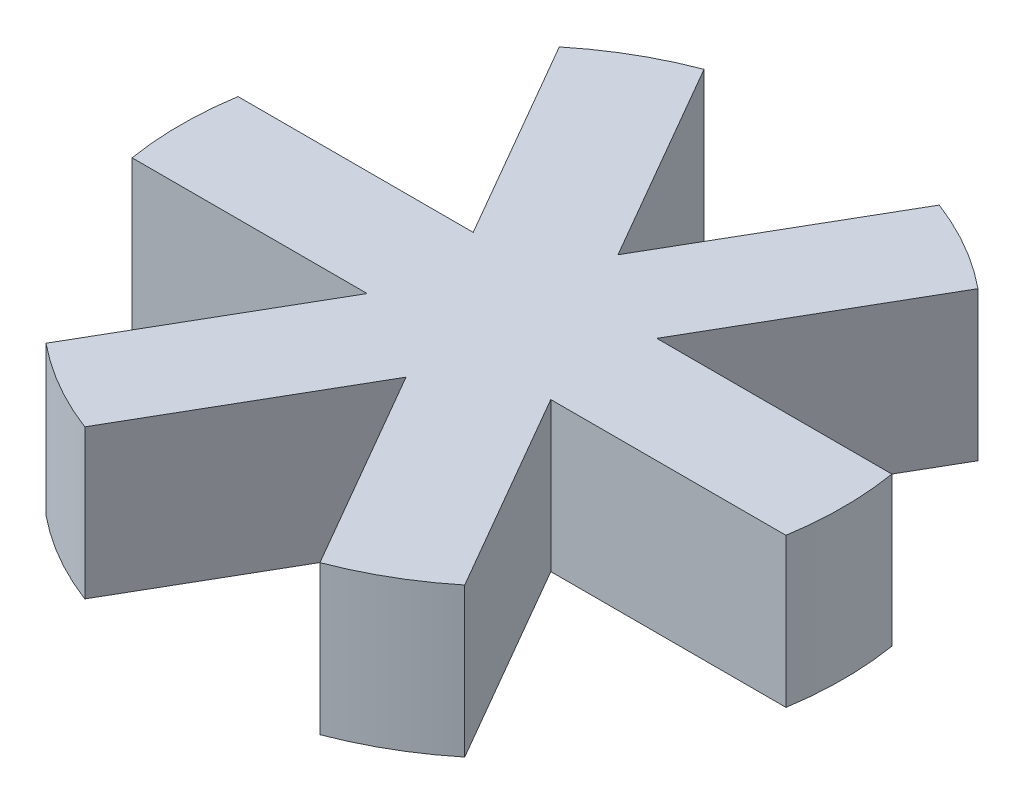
SolidWorks part; units mm, degrees
ref_plane "Front Plane" through (0, 0, 0) normal (0, 0, 1) x (1, 0, 0)
ref_plane "Top Plane" through (0, 0, 0) normal (0, 1, 0) x (1, 0, 0)
ref_plane "Right Plane" through (0, 0, 0) normal (1, 0, 0) x (0, 0, -1)
sketch "Sketch1" plane through (0, 0, 0) normal (0, 1, 0) x (1, 0, 0)
  line L0 (0, 0) -> (7.9375, 0) construction
  line L1 (0, 0) -> (0, 7.9375) construction
  line L2 (0, 1.27) -> (7.8352, 1.27) construction
  line L3 (0, -1.27) -> (7.8352, -1.27) construction
  line L4 (-1.0999, -0.635) -> (2.8178, -7.4205) construction
  line L5 (1.0999, 0.635) -> (5.0175, -6.1505) construction
  line L6 (-1.0999, 0.635) -> (-5.0175, -6.1505) construction
  line L7 (1.0999, -0.635) -> (-2.8178, -7.4205) construction
  line L8 (0, 1.27) -> (-7.8352, 1.27) construction
  line L9 (0, -1.27) -> (-7.8352, -1.27) construction
  line L10 (1.0999, 0.635) -> (-2.8178, 7.4205) construction
  line L11 (-1.0999, -0.635) -> (-5.0175, 6.1505) construction
  line L12 (1.0999, -0.635) -> (5.0175, 6.1505) construction
  line L13 (-1.0999, 0.635) -> (2.8178, 7.4205) construction
  line L14 (2.1997, 1.27) -> (7.8352, 1.27)
  line L15 (2.1997, 1.27) -> (5.0175, 6.1505)
  line L16 (2.1997, -1.27) -> (7.8352, -1.27)
  line L17 (2.1997, -1.27) -> (5.0175, -6.1505)
  line L18 (0, -2.54) -> (2.8178, -7.4205)
  line L19 (0, -2.54) -> (-2.8178, -7.4205)
  line L20 (-2.1997, -1.27) -> (-5.0175, -6.1505)
  line L21 (-2.1997, -1.27) -> (-7.8352, -1.27)
  line L22 (-2.1997, 1.27) -> (-7.8352, 1.27)
  line L23 (-2.1997, 1.27) -> (-5.0175, 6.1505)
  line L24 (0, 2.54) -> (-2.8178, 7.4205)
  line L25 (0, 2.54) -> (2.8178, 7.4205)
  circle A0 centre (0, 0) radius 7.9375 construction
  arc A1 (2.8178, 7.4205) -> (5.0175, 6.1505) centre (0, 0) cw
  arc A2 (7.8352, 1.27) -> (7.8352, -1.27) centre (0, 0) cw
  arc A3 (5.0175, -6.1505) -> (2.8178, -7.4205) centre (0, 0) cw
  arc A4 (-2.8178, -7.4205) -> (-5.0175, -6.1505) centre (0, 0) cw
  arc A5 (-7.8352, -1.27) -> (-7.8352, 1.27) centre (0, 0) cw
  arc A6 (-5.0175, 6.1505) -> (-2.8178, 7.4205) centre (0, 0) cw
  dimension "D2" = 15.875
  dimension "D1" = 2.54
extrude "body" add sketch "Sketch1" along normal blind 3.5719
